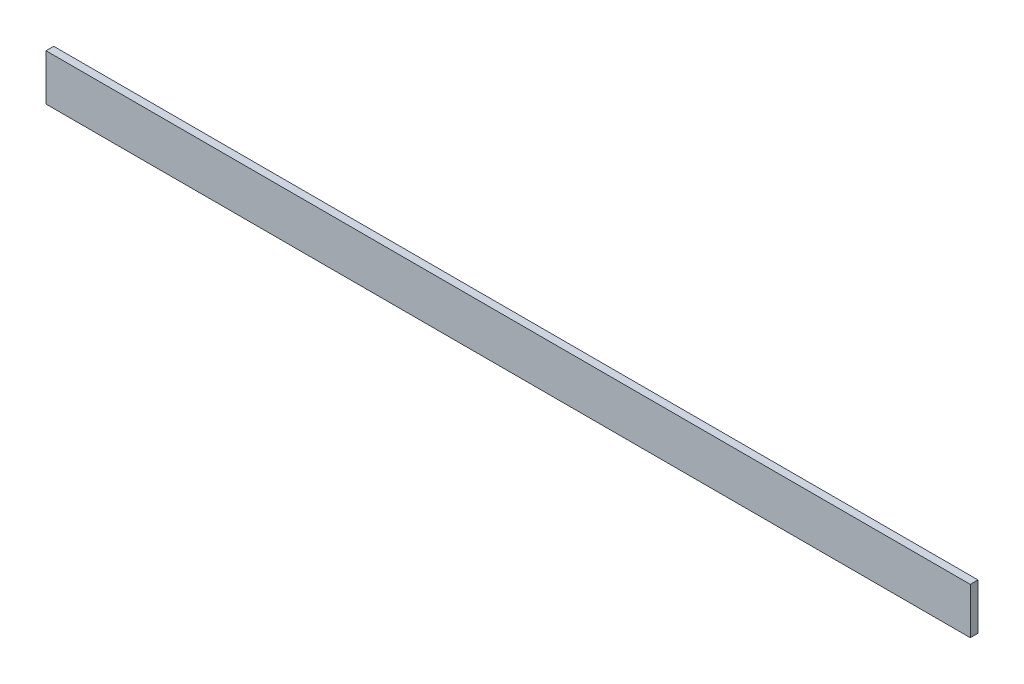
SolidWorks part; units mm, degrees
ref_plane "Plan de face" through (0, 0, 0) normal (0, 0, 1) x (1, 0, 0)
ref_plane "Plan de dessus" through (0, 0, 0) normal (0, 1, 0) x (1, 0, 0)
ref_plane "Plan de droite" through (0, 0, 0) normal (1, 0, 0) x (0, 0, -1)
sketch "Esquisse1" plane through (0, 0, 0) normal (0, 0, 1) x (1, 0, 0)
  line L1 (0, 0) -> (1200, 0)
  line L2 (0, 0) -> (0, 60)
  line L3 (0, 60) -> (1200, 60)
  line L4 (1200, 0) -> (1200, 60)
  dimension "D1" = 1200
  dimension "D2" = 60
extrude "Extrusion1" add sketch "Esquisse1" along normal blind 10
